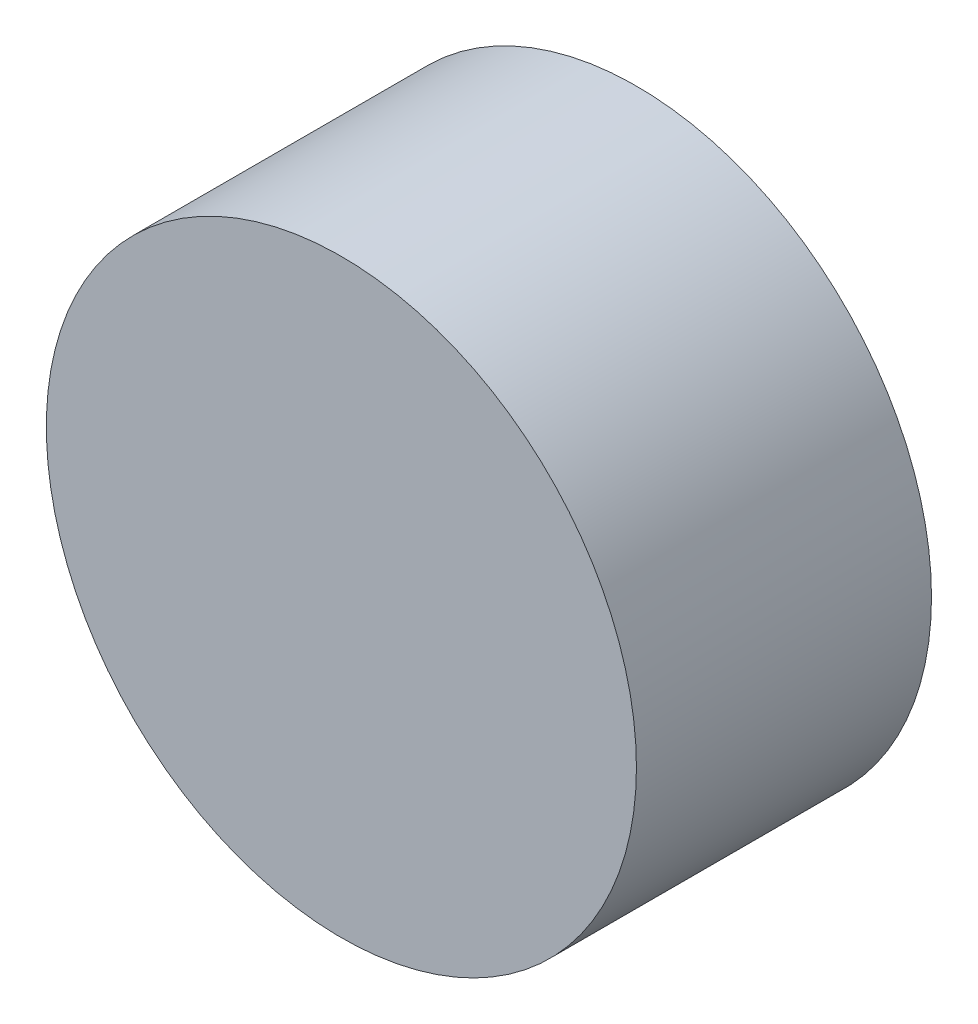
SolidWorks part; units mm, degrees
ref_plane "Plan1" through (0, 0, 0) normal (0, 0, 1) x (1, 0, 0)
ref_plane "Plan2" through (0, 0, 0) normal (0, 1, 0) x (1, 0, 0)
ref_plane "Plan3" through (0, 0, 0) normal (1, 0, 0) x (0, 0, -1)
sketch "Esquisse1" plane through (0, 0, 0) normal (0, 0, 1) x (1, 0, 0)
  circle A0 centre (0, 0) radius 3
  dimension "D1" = 6
extrude "Base-Extrusion" add sketch "Esquisse1" along normal blind 3
